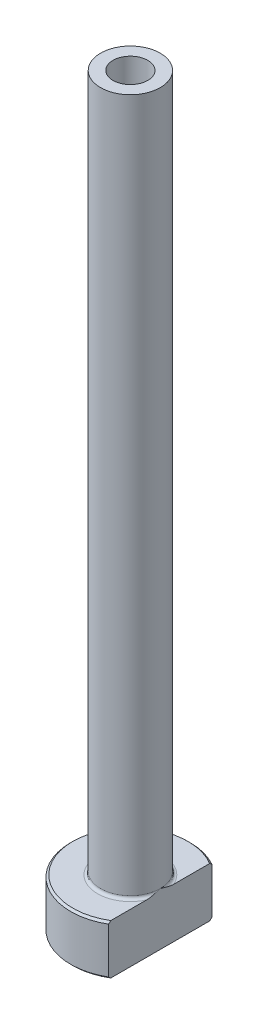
SolidWorks part; units mm, degrees
ref_plane "Front Plane" through (0, 0, 0) normal (0, 0, 1) x (1, 0, 0)
ref_plane "Top Plane" through (0, 0, 0) normal (0, 1, 0) x (1, 0, 0)
ref_plane "Right Plane" through (0, 0, 0) normal (1, 0, 0) x (0, 0, -1)
sketch "Sketch1" plane through (0, 0, 0) normal (0, 0, 1) x (1, 0, 0)
  line L0 (-1.75, 75) -> (-3, 75)
  line L1 (-3, 75) -> (-3, 5)
  line L2 (-3, 5) -> (-6, 5)
  line L3 (-6, 5) -> (-6, 0)
  line L4 (4.95, 0) -> (-4.95, 0) construction
  line L5 (-6, 0) -> (-2, 0)
  line L6 (-1.75, 30) -> (-1.75, 75)
  line L7 (0, 92.1877) -> (0, -15.5353) construction
  line L8 (0, -6.6) -> (0, 6.6) construction
  line L9 (-1.75, 30) -> (-2, 18)
  line L10 (-2, 18) -> (-2, 0)
  dimension "D1" = 0.25
  dimension "ID" = 3.5
  dimension "OD" = 6
  dimension "L" = 75
  dimension "H" = 12
  dimension "T" = 5
  dimension "N" = 45
  dimension "D2" = 12
  dimension "L-N" = 30
revolve "Revolve1" add sketch "Sketch1" angle 360 about L7
fillet "Fillet1" radius 0.3 1 edges at (0, 5, 3)
chamfer "Chamfer1" distance 0.2 angle 45 2 edges at (0, 5, 6) (0, 0, 6)
sketch "Sketch2" plane through (0, 0, 0) normal (0, -1, 0) x (1, 0, 0)
  line L0 (3, 5.1962) -> (3, -5.1962)
  circle A0 centre (0, 0) radius 6 construction
  arc A1 (3, 5.1962) -> (3, -5.1962) centre (0, 0) cw
  circle A2 centre (0, 0) radius 3 construction
extrude "Cut-Extrude1" cut sketch "Sketch2" against normal through all
chamfer "Chamfer2" distance 0.5 angle 45 1 edges at (0, 0, 2)
